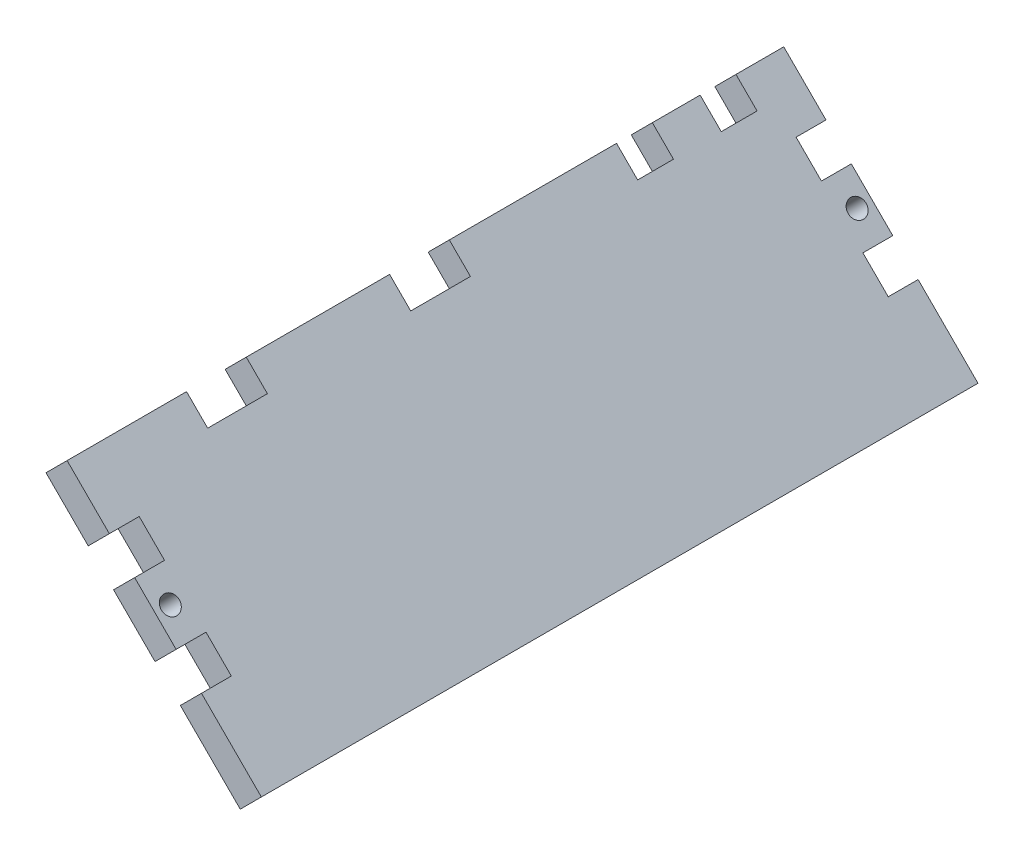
SolidWorks part; units mm, degrees
ref_plane "Front Plane" through (0, 0, 0) normal (0, 0, 1) x (1, 0, 0)
ref_plane "Top Plane" through (0, 0, 0) normal (0, 1, 0) x (1, 0, 0)
ref_plane "Right Plane" through (0, 0, 0) normal (1, 0, 0) x (0, 0, -1)
sketch "Sketch1" plane through (0, 0, 0) normal (0, 0, 1) x (1, 0, 0)
  line L0 (0, 0) -> (-28.575, 0) construction
  line L1 (-28.575, 0) -> (-28.575, 28.575) construction
  line L3 (-28.575, 28.575) -> (0, 0) construction
  dimension "D1" = 28.575
  dimension "D2" = 28.575
sketch "Sketch5" plane through (0, 0, 0) normal (1, 0, 0) x (0, 0, -1)
  line L0 (0, 0) -> (-152.4, 0) construction
  dimension "D1" = 152.4
ref_plane "Plane2" through (0, 0, 0) normal (-0.7071, -0.7071, 0) x (-0.7071, 0.7071, 0)
sketch "Sketch7" plane through (0, 0, 0) normal (-0.7071, -0.7071, 0) x (-0.7071, 0.7071, 0)
  line L0 (40.4112, 0) -> (0, 0) construction
  line L1 (58.42, 0) -> (0, 0)
  line L2 (58.42, 0) -> (58.42, -152.4)
  line L3 (58.42, -152.4) -> (0, -152.4)
  line L4 (0, 0) -> (0, -152.4)
  line L5 (25.6311, -3.175) -> (38.1, -3.175) construction
  line L6 (18.0111, 0) -> (25.6311, 0)
  line L7 (18.0111, 0) -> (18.0111, -6.35)
  line L8 (18.0111, -6.35) -> (25.6311, -6.35)
  line L9 (25.6311, 0) -> (25.6311, -6.35)
  line L10 (38.1, 0) -> (45.72, 0)
  line L11 (38.1, 0) -> (38.1, -6.35)
  line L12 (38.1, -6.35) -> (45.72, -6.35)
  line L13 (45.72, 0) -> (45.72, -6.35)
  line L14 (25.6311, -149.225) -> (38.1, -149.225) construction
  line L15 (18.0111, -152.4) -> (25.6311, -152.4)
  line L16 (18.0111, -152.4) -> (18.0111, -146.05)
  line L17 (18.0111, -146.05) -> (25.6311, -146.05)
  line L18 (25.6311, -152.4) -> (25.6311, -146.05)
  line L19 (38.1, -152.4) -> (45.72, -152.4)
  line L20 (38.1, -152.4) -> (38.1, -146.05)
  line L21 (38.1, -146.05) -> (45.72, -146.05)
  line L22 (45.72, -152.4) -> (45.72, -146.05)
  line L23 (18.0111, -6.35) -> (18.0111, -146.05) construction
  line L24 (0, -76.2) -> (58.42, -76.2) construction
  line L29 (58.42, -114.3) -> (52.07, -114.3)
  line L36 (58.42, -114.3) -> (58.42, -127)
  line L37 (58.42, -127) -> (52.07, -127)
  line L38 (52.07, -114.3) -> (52.07, -127)
  line L39 (58.42, -71.12) -> (52.07, -71.12)
  line L40 (58.42, -71.12) -> (58.42, -83.82)
  line L41 (58.42, -83.82) -> (52.07, -83.82)
  line L42 (52.07, -71.12) -> (52.07, -83.82)
  line L51 (58.42, -10.16) -> (52.07, -10.16)
  line L52 (58.42, -10.16) -> (58.42, -17.78)
  line L53 (58.42, -17.78) -> (52.07, -17.78)
  line L54 (52.07, -10.16) -> (52.07, -17.78)
  line L55 (58.42, -27.94) -> (52.07, -27.94)
  line L56 (58.42, -27.94) -> (58.42, -35.56)
  line L57 (58.42, -35.56) -> (52.07, -35.56)
  line L58 (52.07, -27.94) -> (52.07, -35.56)
  circle A2 centre (31.8656, -3.175) radius 1.905
  circle A3 centre (31.8656, -149.225) radius 1.905
  dimension "D14" = 3.81
  dimension "D15" = 3.81
  dimension "D1" = 58.42
  dimension "D3" = 10.16
  dimension "D4" = 6.35
  dimension "D5" = 7.62
  dimension "D6" = 7.62
  dimension "D7" = 12.4689
  dimension "D8" = 6.35
  dimension "D9" = 6.35
  dimension "D10" = 7.62
  dimension "D11" = 7.62
  dimension "D12" = 12.4689
  dimension "D13" = 12.7
  dimension "D19" = 6.35
  dimension "D20" = 6.35
  dimension "D21" = 12.7
  dimension "D22" = 12.7
  dimension "D23" = 30.48
  dimension "D24" = 25.4
  dimension "D25" = 10.16
  dimension "D26" = 7.62
  dimension "D27" = 7.62
  dimension "D28" = 6.35
  dimension "D29" = 6.35
  dimension "D30" = 12.7
  dimension "D31" = 6.35
extrude "Boss-Extrude4" add sketch "Sketch7" along normal blind 6.35
